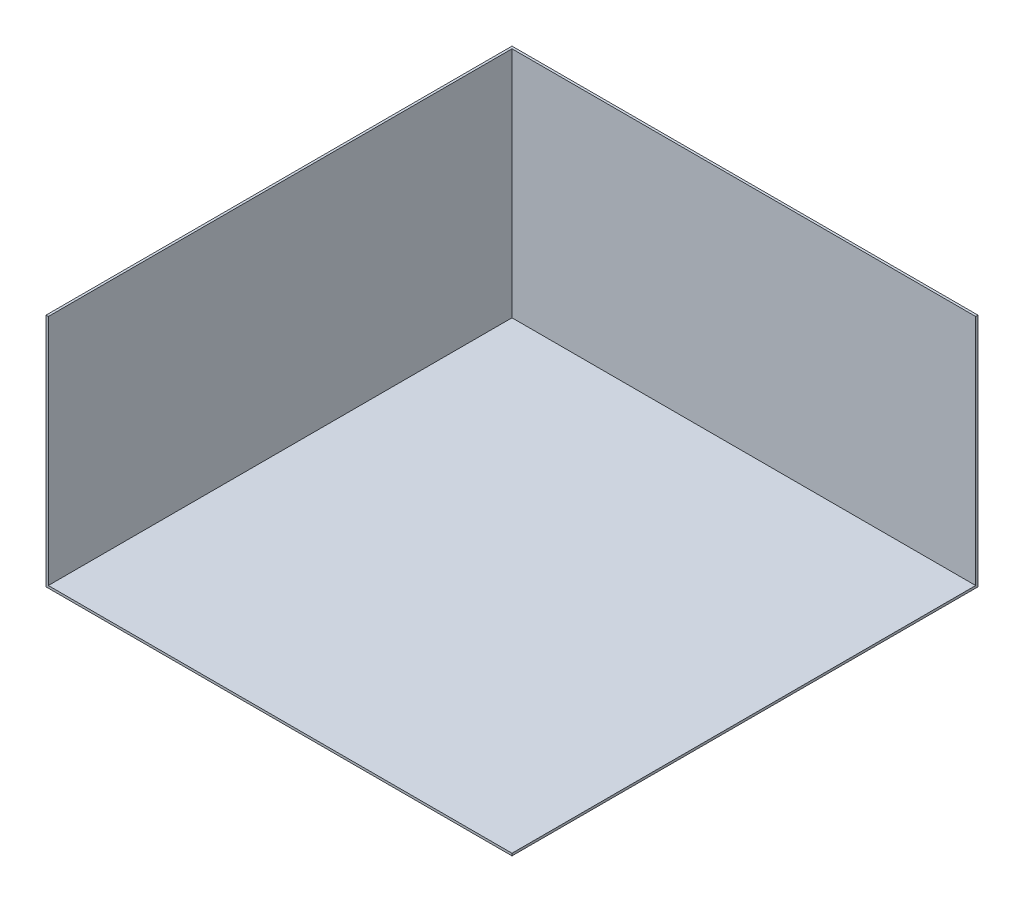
SolidWorks part; units mm, degrees
ref_plane "Front Plane" through (0, 0, 0) normal (0, 0, 1) x (1, 0, 0)
ref_plane "Top Plane" through (0, 0, 0) normal (0, 1, 0) x (1, 0, 0)
ref_plane "Right Plane" through (0, 0, 0) normal (1, 0, 0) x (0, 0, -1)
sketch "Sketch1" plane through (0, 0, 0) normal (0, 1, 0) x (1, 0, 0)
  line L1 (0, 0) -> (-5080, 0)
  line L2 (0, 0) -> (0, -5080)
  line L3 (0, -5080) -> (-5080, -5080)
  line L4 (-5080, 0) -> (-5080, -5080)
  dimension "D1" = 5080
  dimension "D2" = 5080
extrude "Boss-Extrude1" add sketch "Sketch1" along normal blind 25.4
sketch "Sketch2" plane through (0, 25.4, 0) normal (0, 1, 0) x (1, 0, 0)
  line L0 (0, 0) -> (-5080, 0) construction
  line L1 (-5080, -5080) -> (-5054.6, -5080)
  line L2 (-5080, -5080) -> (-5080, 0)
  line L3 (-5080, 0) -> (-5054.6, 0)
  line L4 (-5054.6, -5080) -> (-5054.6, 0)
  line L6 (0, 0) -> (-5054.6, 0)
  line L7 (0, 0) -> (0, -25.4)
  line L8 (0, -25.4) -> (-5054.6, -25.4)
  line L9 (-5054.6, 0) -> (-5054.6, -25.4)
  dimension "D1" = 25.4
extrude "Boss-Extrude2" add sketch "Sketch2" along normal blind 2540 contours L4 L1 L2 L3 | L9 L8 L7 L6
